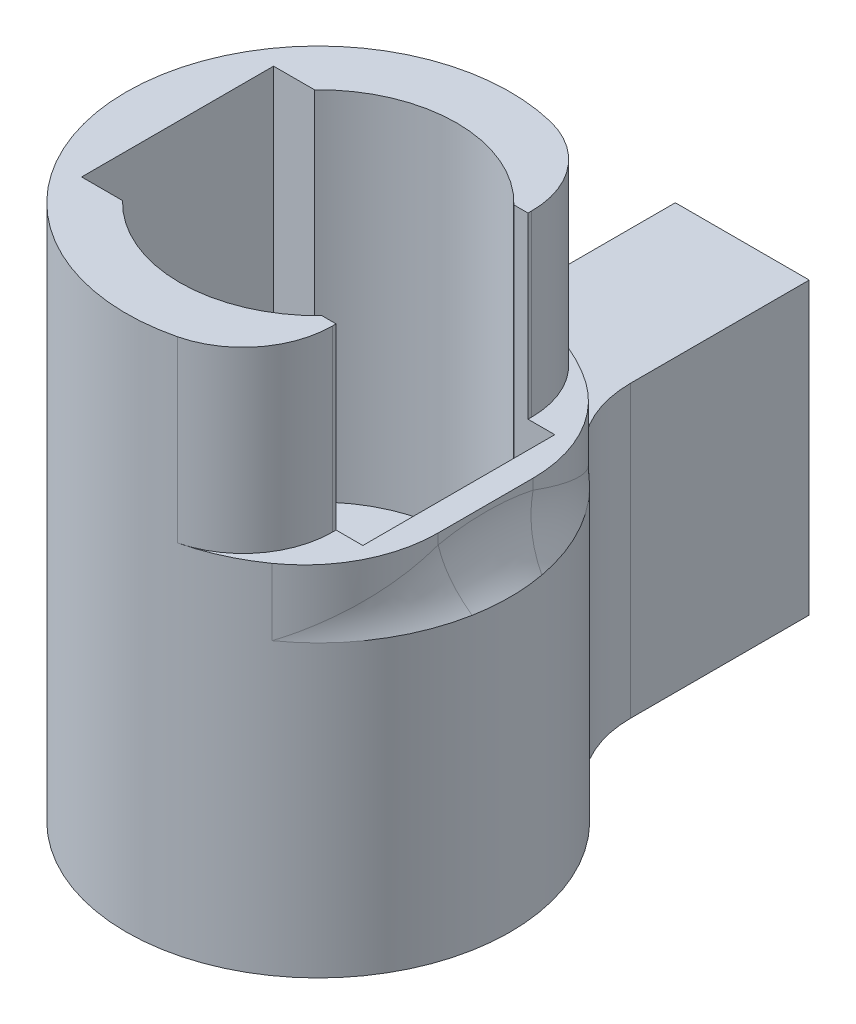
SolidWorks part; units mm, degrees
ref_plane "Спереди" through (0, 0, 0) normal (0, 0, 1) x (1, 0, 0)
ref_plane "Сверху" through (0, 0, 0) normal (0, 1, 0) x (1, 0, 0)
ref_plane "Справа" through (0, 0, 0) normal (1, 0, 0) x (0, 0, -1)
sketch "Sketch1" plane through (0, 0, 0) normal (0, 1, 0) x (1, 0, 0)
  circle A0 centre (0, 0) radius 4.3
  circle A1 centre (0, 0) radius 1.6
  dimension "D1" = 8.6
  dimension "D2" = 3.2
extrude "Boss-Extrude1" add sketch "Sketch1" along normal blind 12
sketch "Sketch2" plane through (0, 12, 0) normal (0, 1, 0) x (1, 0, 0)
  circle A0 centre (0, 0) radius 3.1
  dimension "D1" = 6.2
extrude "Cut-Extrude1" cut sketch "Sketch2" against normal blind 8
sketch "Sketch3" plane through (0, 12, 0) normal (0, 1, 0) x (1, 0, 0)
  line L1 (3.15, -2.15) -> (-3.15, -2.15)
  line L2 (3.15, -2.15) -> (3.15, 2.15)
  line L3 (3.15, 2.15) -> (-3.15, 2.15)
  line L4 (-3.15, -2.15) -> (-3.15, 2.15)
  line L5 (3.15, -2.15) -> (-3.15, 2.15) construction
  line L6 (3.15, 2.15) -> (-3.15, -2.15) construction
  point P0 (0, 0)
  dimension "D1" = 4.3
  dimension "D2" = 6.3
extrude "Cut-Extrude2" cut sketch "Sketch3" against normal blind 6
sketch "Sketch6" plane through (0, 0, 0) normal (0, -1, 0) x (1, 0, 0)
  line L0 (-4.3, 0) -> (4.3, 0) construction
  line L1 (0, 0) -> (0, 10) construction
  line L2 (0, 0) -> (0, -10) construction
  line L3 (1.5, 9.5) -> (-1.5, 9.5) construction
  line L4 (1.5, 9.5) -> (1.5, 3.5) construction
  line L5 (1.5, 3.5) -> (-1.5, 3.5) construction
  line L6 (-1.5, 9.5) -> (-1.5, 3.5) construction
  line L7 (1.5, 9.5) -> (-1.5, 3.5) construction
  line L8 (1.5, 3.5) -> (-1.5, 9.5) construction
  line L10 (1.5, -9.5) -> (-1.5, -9.5)
  line L11 (1.5, -9.5) -> (1.5, -3.5)
  line L12 (1.5, -3.5) -> (-1.5, -3.5)
  line L13 (-1.5, -9.5) -> (-1.5, -3.5)
  line L14 (1.5, -9.5) -> (-1.5, -3.5) construction
  line L15 (1.5, -3.5) -> (-1.5, -9.5) construction
  circle A0 centre (0, 0) radius 4.3 construction
  point P8 (0, 6.5)
  point P13 (0, -6.5)
  dimension "D1" = 10
  dimension "D2" = 3.5
  dimension "D3" = 6
  dimension "D4" = 3
  dimension "D5" = 3.5
extrude "Boss-Extrude3" add sketch "Sketch6" against normal blind 6.5
sketch "Sketch7" plane through (0, 12, 0) normal (0, 1, 0) x (1, 0, 0)
  line L0 (-3.75, 2.1042) -> (-3.75, -2.1042) construction
  line L1 (3.75, 2.1042) -> (3.75, -2.1042) construction
  line L2 (-3.15, 2.15) -> (-3.15, -2.15) construction
  line L4 (3.75, 2.1042) -> (3.75, -2.1042)
  circle A0 centre (0, 0) radius 4.3 construction
  arc A2 (3.75, 2.1042) -> (3.75, -2.1042) centre (0.1236, 0) cw
  dimension "D1" = 7.5
extrude "Cut-Extrude4" cut sketch "Sketch7" against normal blind 5.5
fillet "Fillet1" radius 3 2 edges at (3.75, 9.25, -2.1042) (3.75, 9.25, 2.1042)
fillet "Fillet2" radius 2 3 edges at (3.4139, 6.5, -2.4416) (3.4139, 6.5, 2.4416) (3.75, 6.5, 0)
sketch "Sketch9" plane through (0, 12, 0) normal (0, 1, 0) x (1, 0, 0)
  line L0 (2.55, 3.4618) -> (2.55, -3.4618)
  line L2 (3.75, 1.0618) -> (3.75, -1.0618)
  arc A0 (3.75, 1.0618) -> (2.4808, 3.5122) centre (0.75, 1.0618) ccw construction
  arc A1 (2.4808, -3.5122) -> (3.75, -1.0618) centre (0.75, -1.0618) ccw construction
  arc A2 (3.75, 1.0618) -> (2.55, 3.4618) centre (0.75, 1.0618) ccw
  arc A3 (3.75, -1.0618) -> (2.55, -3.4618) centre (0.75, -1.0618) cw
  dimension "D1" = 1.2
extrude "Cut-Extrude6" cut sketch "Sketch9" against normal blind 4
fillet "Fillet4" radius 2.5 2 edges at (1.5, 3.25, -4.0299) (-1.5, 3.25, -4.0299)
fillet "Fillet5" radius 2 2 edges at (2.55, 10, -3.4618) (2.55, 10, 3.4618)
